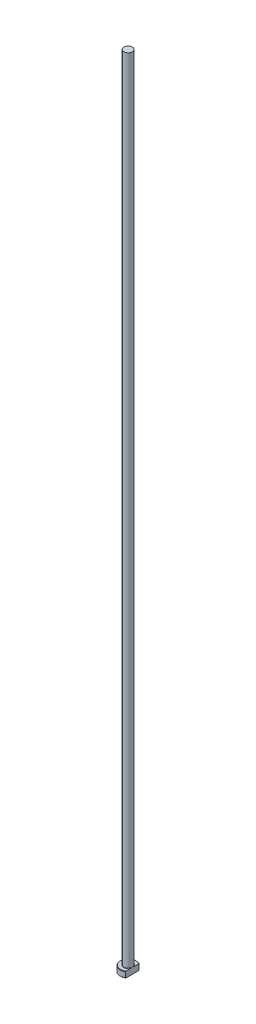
SolidWorks part; units mm, degrees
ref_plane "Front Plane" through (0, 0, 0) normal (0, 0, 1) x (1, 0, 0)
ref_plane "Top Plane" through (0, 0, 0) normal (0, 1, 0) x (1, 0, 0)
ref_plane "Right Plane" through (0, 0, 0) normal (1, 0, 0) x (0, 0, -1)
sketch "Sketch1" plane through (0, 0, 0) normal (0, 0, 1) x (1, 0, 0)
  line L0 (0, 259.9588) -> (0, -15.1925) construction
  line L1 (0, 0) -> (-4, 0)
  line L2 (-4, 0) -> (-4, 3)
  line L3 (-4, 3) -> (-2.1, 3)
  line L4 (-2.1, 3) -> (-2.1, 400)
  line L5 (-2.1, 400) -> (0, 400)
  line L6 (0, 400) -> (0, 0)
  dimension "L" = 400
  dimension "H" = 8
  dimension "T" = 3
  dimension "D" = 4.2
revolve "Revolve1" add sketch "Sketch1" angle 360 about L0
chamfer "Chamfer1" distance 0.2 angle 45 2 edges at (0, 3, 4) (0, 0, 4)
fillet "Fillet1" radius 0.2 1 edges at (0, 3, 2.1)
sketch "Sketch2" plane through (0, 0, 0) normal (0, 1, 0) x (1, 0, 0)
  line L0 (2.1, 3.4044) -> (2.1, -3.4044)
  circle A0 centre (0, 0) radius 4 construction
  arc A1 (2.1, -3.4044) -> (2.1, 3.4044) centre (0, 0) ccw
  circle A2 centre (0, 0) radius 2.1 construction
extrude "KEY" cut sketch "Sketch2" along normal through all
